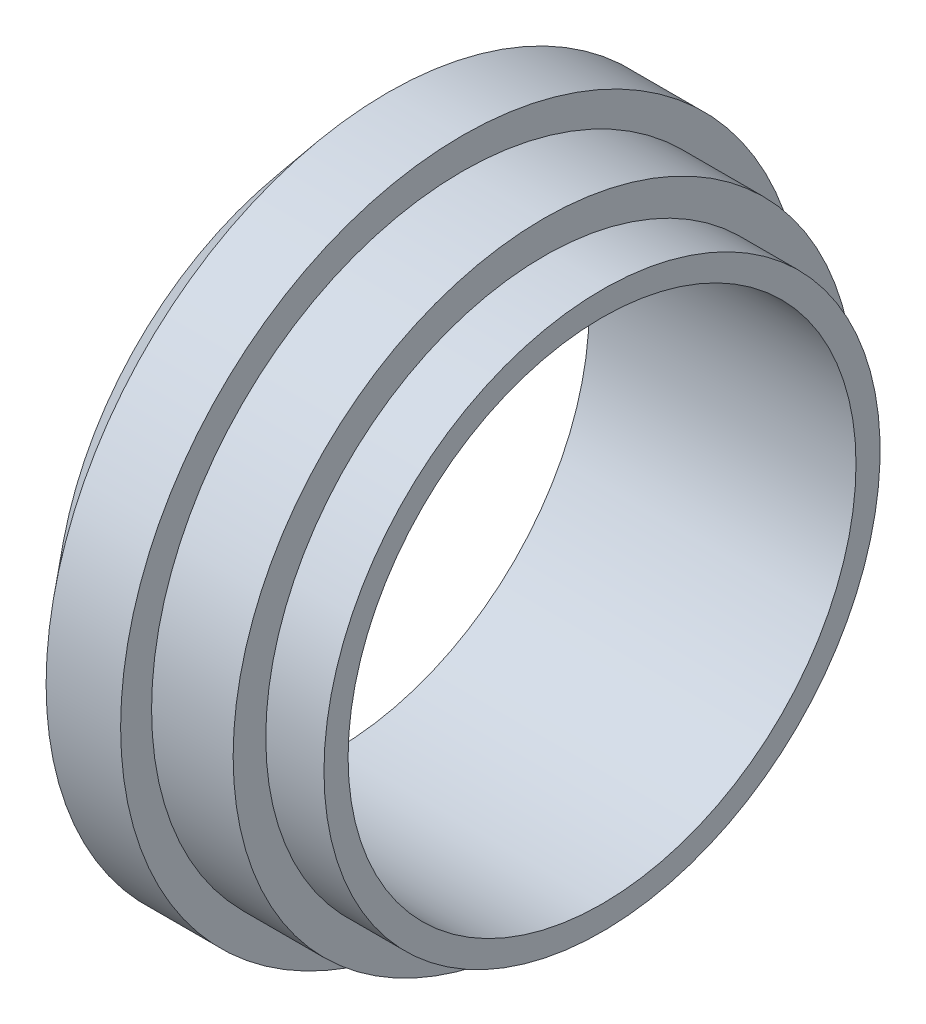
SolidWorks part; units mm, degrees
ref_plane "Front Plane" through (0, 0, 0) normal (0, 0, 1) x (1, 0, 0)
ref_plane "Top Plane" through (0, 0, 0) normal (0, 1, 0) x (1, 0, 0)
ref_plane "Right Plane" through (0, 0, 0) normal (1, 0, 0) x (0, 0, -1)
sketch "Sketch1" plane through (0, 0, 0) normal (0, 0, 1) x (1, 0, 0)
  line L0 (0, 0) -> (-3.9878, 0)
  line L1 (-3.9878, 0) -> (-3.9878, -2.2352)
  line L2 (-3.9878, -2.2352) -> (-9.5758, -2.2352)
  line L3 (-9.5758, -2.2352) -> (-9.5758, -4.3561)
  line L4 (-9.5758, -4.3561) -> (-14.6812, -4.3561)
  line L5 (-14.6812, -4.3561) -> (-18.288, -0.0508)
  line L6 (-18.288, -0.0508) -> (-18.288, 19.05)
  line L7 (-18.288, 19.05) -> (0, 19.05)
  line L8 (0, 19.05) -> (0, 0)
  dimension "D1" = 19.05
  dimension "D2" = 3.6068
  dimension "D3" = 8.7122
  dimension "D4" = 14.3002
  dimension "D5" = 18.288
  dimension "D6" = 19.1008
  dimension "D7" = 23.4061
  dimension "D8" = 21.2852
revolve "Revolve1" add sketch "Sketch1" angle 360 about L7
sketch "Sketch4" plane through (-18.288, 0, 0) normal (-1, 0, 0) x (0, 0, 1)
  circle A0 centre (0, 19.05) radius 17.399
extrude "Cut-Extrude1" cut sketch "Sketch4" against normal through all contours A0
